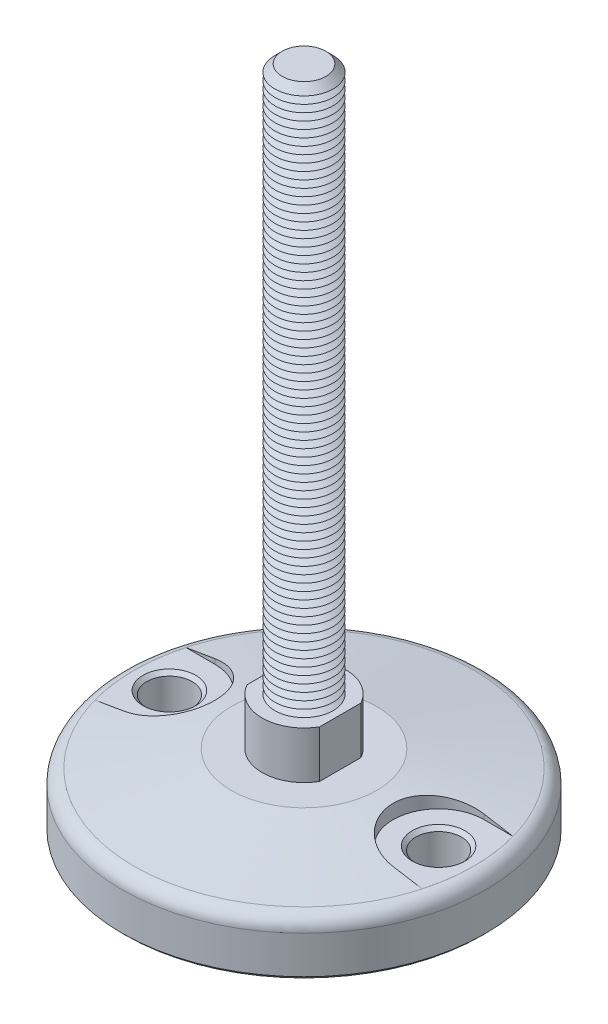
SolidWorks part; units mm, degrees
ref_plane "Front Plane" through (0, 0, 0) normal (0, 0, 1) x (1, 0, 0)
ref_plane "Top Plane" through (0, 0, 0) normal (0, 1, 0) x (1, 0, 0)
ref_plane "Right Plane" through (0, 0, 0) normal (1, 0, 0) x (0, 0, -1)
sketch "Sketch1" plane through (0, 0, 0) normal (1, 0, 0) x (0, 0, -1)
  line L0 (0, 61.3389) -> (0, -58.404) construction
sketch "Sketch2" plane through (0, 0, 0) normal (1, 0, 0) x (0, 0, -1)
  line L0 (0, 0) -> (-20, 0)
  line L1 (-20, 0) -> (-50, -5.2898)
  line L2 (-50, -5.2898) -> (-50, -20)
  line L3 (-50, -20) -> (0, -20)
  line L4 (0, 61.3389) -> (0, -58.404) construction
  line L5 (0, -20) -> (0, 0)
  dimension "D1" = 20
  dimension "D2" = 50
  dimension "D3" = 20
  dimension "D4" = 10
revolve "Revolve1" add sketch "Sketch2" angle 360 about L0
fillet "Fillet1" radius 4 1 edges at (0, -5.2898, 50)
sketch "Sketch3" plane through (0, 0, 0) normal (0, 1, 0) x (1, 0, 0)
  circle A0 centre (0, 0) radius 11.5
  dimension "D1" = 23
extrude "Boss-Extrude1" add sketch "Sketch3" along normal blind 13
sketch "Sketch4" plane through (0, 13, 0) normal (0, 1, 0) x (1, 0, 0)
  line L0 (-10, 5.6789) -> (-10, -5.6789)
  line L2 (10, -5.6789) -> (10, 5.6789)
  arc A0 (-10, 5.6789) -> (-10, -5.6789) centre (0, 0) ccw
  circle A1 centre (0, 0) radius 11.5 construction
  arc A2 (10, -5.6789) -> (10, 5.6789) centre (0, 0) ccw
  dimension "D1" = 20
extrude "Cut-Extrude1" cut sketch "Sketch4" against normal blind 13
sketch "Sketch5" plane through (0, 13, 0) normal (0, 1, 0) x (1, 0, 0)
  circle A0 centre (0, 0) radius 8
  dimension "D1" = 16
extrude "Boss-Extrude2" add sketch "Sketch5" along normal blind 150
chamfer "Chamfer1" distance 2 angle 45 1 edges at (0, 163, 8)
sketch "Sketch6" plane through (0, 0, 0) normal (1, 0, 0) x (0, 0, -1)
  line L0 (-8, 13) -> (-6.2679, 14)
  line L1 (-6.2679, 14) -> (-8, 15)
  line L2 (-8, 161) -> (-8, 13) construction
  line L3 (-8, 15) -> (-8, 13)
  dimension "D1" = 2
revolve "Cut-Revolve1" cut sketch "Sketch6" angle 360 about L0
pattern_linear "LPattern1" count 74 spacing 2 along (0, 1, 0) of "Cut-Revolve1"
sketch "Sketch8" plane through (0, 0, 0) normal (0, 1, 0) x (1, 0, 0)
  line L0 (-37, 12.5) -> (-44.9904, 12.5)
  line L1 (-37, -12.5) -> (-44.9904, -12.5)
  arc A1 (-44.9904, 12.5) -> (-44.9904, -12.5) centre (0, 0) ccw
  circle A2 centre (0, 0) radius 46.6946 construction
  arc A3 (-37, -12.5) -> (-37, 12.5) centre (-37, 0) ccw
  point P3 (-37, 0)
  point P11 (0, 0)
  dimension "D1" = 37
  dimension "D2" = 25
extrude "Cut-Extrude4" cut sketch "Sketch8" against normal blind 4.7
sketch "Sketch10" plane through (0, -4.7, 0) normal (0, 1, 0) x (1, 0, 0)
  circle A0 centre (-37, 0) radius 6.25
  dimension "D1" = 12.5
extrude "Cut-Extrude5" cut sketch "Sketch10" against normal up to surface (15.3 mm away)
chamfer "Chamfer2" distance 1 angle 45 2 edges at (-37, -20, -6.25) (-37, -4.7, 6.25)
mirror "Mirror1" about plane through (0, 0, 0) normal (1, 0, 0) of "Chamfer2", "Cut-Extrude5", "Cut-Extrude4"
chamfer "Chamfer3" distance 1 angle 45 1 edges at (0, -20, 50)
